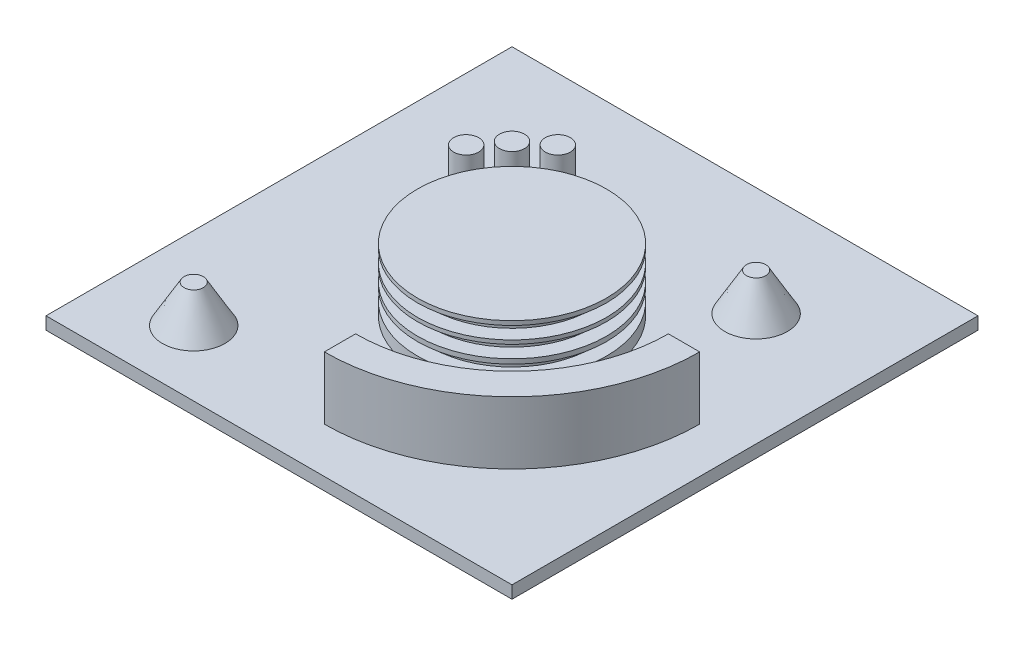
SolidWorks part; units mm, degrees
ref_plane "Front Plane" through (0, 0, 0) normal (0, 0, 1) x (1, 0, 0)
ref_plane "Top Plane" through (0, 0, 0) normal (0, 1, 0) x (1, 0, 0)
ref_plane "Right Plane" through (0, 0, 0) normal (1, 0, 0) x (0, 0, -1)
sketch "Sketch1" plane through (0, 0, 0) normal (0, 1, 0) x (1, 0, 0)
  line L0 (-47.2963, 47.2963) -> (47.2963, -47.2963) construction
  line L1 (-47.2963, -47.2963) -> (47.2963, -47.2963)
  line L2 (-47.2963, -47.2963) -> (-47.2963, 47.2963)
  line L3 (-47.2963, 47.2963) -> (47.2963, 47.2963)
  line L4 (47.2963, -47.2963) -> (47.2963, 47.2963)
extrude "Extrude1" add sketch "Sketch1" along normal blind 2.54
sketch "Sketch2" plane through (0, 2.54, 0) normal (0, 1, 0) x (-1, 0, 0)
  line L1 (0, 31.75) -> (0, 38.1)
  line L2 (0, 0) -> (12.7, -21.997) construction
  line L3 (0, 0) -> (17.9605, -17.9605) construction
  line L4 (0, 0) -> (21.997, -12.7) construction
  line L5 (0, 0) -> (42.7666, 0) construction
  line L6 (0, 0) -> (-13.4181, -28.7753) construction
  line L7 (0, 0) -> (22.4506, 22.4506) construction
  line L8 (-31.75, 0) -> (-38.1, 0)
  circle A0 centre (0, 0) radius 19.185
  circle A1 centre (0, 0) radius 31.75 construction
  circle A2 centre (12.7, -21.997) radius 2.54
  circle A3 centre (17.9605, -17.9605) radius 2.54
  circle A4 centre (21.997, -12.7) radius 2.54
  circle A5 centre (0, 0) radius 25.4 construction
  arc A8 (-31.75, 0) -> (0, 31.75) centre (0, 0) cw
  arc A9 (0, 38.1) -> (-38.1, 0) centre (0, 0) ccw
  dimension "D4" = 65
  dimension "D5" = 63.5
  dimension "D6" = 50.8
  dimension "D7" = 5.08
  dimension "D9" = 38.1
  dimension "D1" = 30
  dimension "D2" = 15
  dimension "D3" = 15
  dimension "D8" = 45
extrude "Extrude2" add sketch "Sketch2" along normal blind 12.7
sketch "Sketch3" plane through (0, 2.54, 0) normal (0, 1, 0) x (1, 0, 0)
  circle A0 centre (24.3768, 25.1817) radius 6.35
  circle A1 centre (-30.6028, -34.0079) radius 6.35
  dimension "D1" = 12.7
  dimension "D2" = 12.7
extrude "Boss-Extrude1" add sketch "Sketch3" along normal blind 7.62 draft 30
sketch "Sketch5" plane through (0, 0, 0) normal (1, 0, 0) x (0, 0, -1)
  line L1 (16.2968, 14.3922) -> (22.8272, 14.3922)
  line L2 (16.2968, 14.3922) -> (16.2968, 11.8522)
  line L3 (16.2968, 11.8522) -> (22.8272, 11.8522)
  line L4 (22.8272, 14.3922) -> (22.8272, 11.8522)
  line L5 (16.2968, 11.0803) -> (22.8272, 11.0803)
  line L6 (16.2968, 11.0803) -> (16.2968, 8.5403)
  line L7 (16.2968, 8.5403) -> (22.8272, 8.5403)
  line L8 (22.8272, 11.0803) -> (22.8272, 8.5403)
  line L9 (16.2968, 7.5872) -> (22.8272, 7.5872)
  line L10 (16.2968, 7.5872) -> (16.2968, 5.0472)
  line L11 (16.2968, 5.0472) -> (22.8272, 5.0472)
  line L12 (22.8272, 7.5872) -> (22.8272, 5.0472)
  dimension "D1" = 2.54
  dimension "D2" = 2.54
  dimension "D3" = 2.54
ref_axis "Axis1" through (0, 15.24, 0) along (0, -1, 0)
revolve "Cut-Revolve1" cut sketch "Sketch5" angle 360 about axis through (0, 15.24, 0) along (0, -1, 0)
